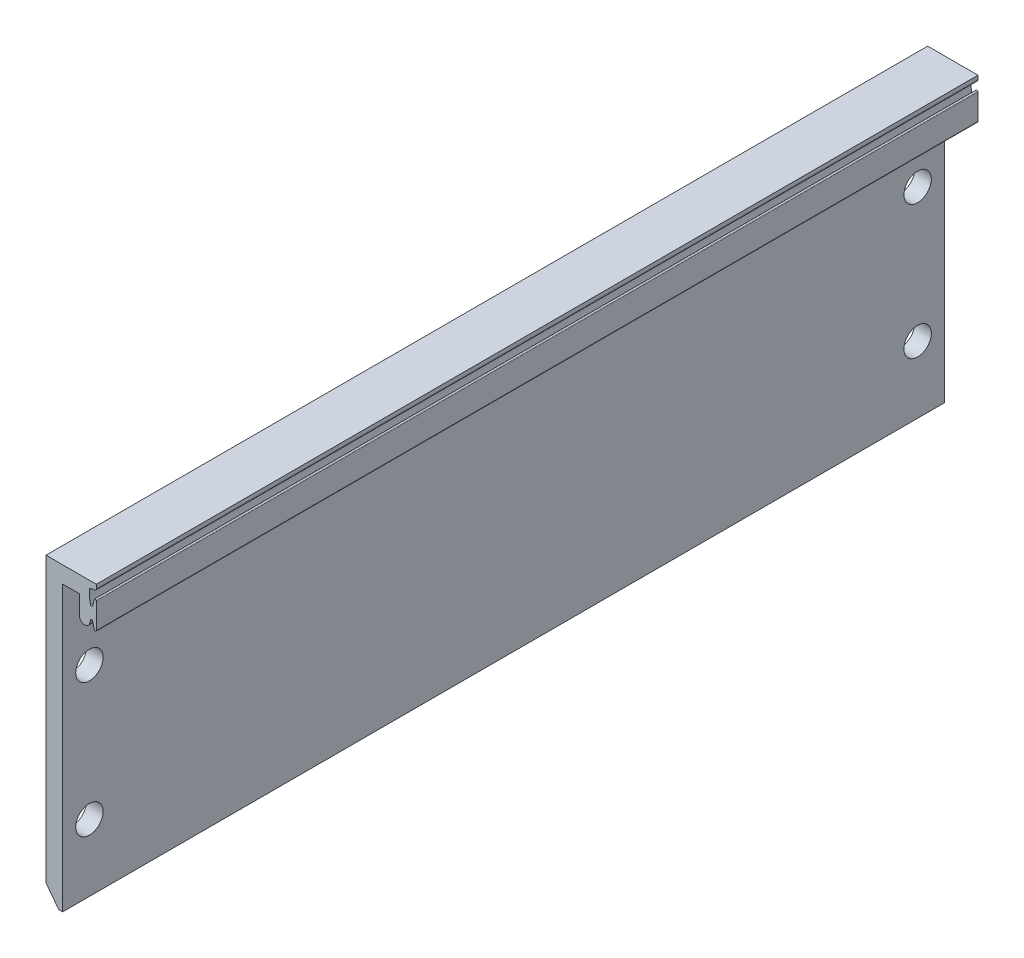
SolidWorks part; units mm, degrees
ref_plane "前视基准面" through (0, 0, 0) normal (0, 0, 1) x (1, 0, 0)
ref_plane "上视基准面" through (0, 0, 0) normal (0, 1, 0) x (1, 0, 0)
ref_plane "右视基准面" through (0, 0, 0) normal (1, 0, 0) x (0, 0, -1)
sketch "草图1" plane through (0, 0, 0) normal (0, 0, 1) x (1, 0, 0)
  line L3 (2260.201, -3063.3015) -> (2260.201, -3066.1678)
  line L4 (2262.741, -3060.8015) -> (2262.741, -3061.3761)
  line L6 (2261.7412, -3066.3727) -> (2261.8863, -3065.8372)
  line L7 (2262.1766, -3065.8405) -> (2262.4208, -3066.828)
  line L8 (2262.741, -3066.789) -> (2262.741, -3062.964)
  line L9 (2262.4208, -3062.925) -> (2262.1766, -3063.9125)
  line L10 (2261.9399, -3061.7612) -> (2262.489, -3061.6723)
  line L11 (2262.741, -3061.3761) -> (2262.741, -3060.8015)
  line L12 (2262.741, -3060.8015) -> (2255.201, -3060.8015)
  line L13 (2255.201, -3060.8015) -> (2255.201, -3103.3015)
  line L14 (2255.201, -3103.3015) -> (2257.101, -3105.8015)
  line L15 (2257.101, -3105.8015) -> (2257.701, -3105.8015)
  line L16 (2257.701, -3105.8015) -> (2257.701, -3063.3015)
  line L17 (2257.701, -3063.3015) -> (2260.201, -3063.3015)
  line L18 (2260.201, -3063.3015) -> (2260.201, -3066.1678)
  arc A0 (2260.201, -3066.1678) -> (2261.7412, -3066.3727) centre (2260.9847, -3066.1678) ccw
  arc A1 (2262.1766, -3065.8405) -> (2261.8863, -3065.8372) centre (2262.031, -3065.8765) ccw
  arc A2 (2262.4208, -3066.828) -> (2262.741, -3066.789) centre (2262.5785, -3066.789) ccw
  arc A3 (2262.741, -3062.964) -> (2262.4208, -3062.925) centre (2262.5785, -3062.964) ccw
  arc A4 (2261.8821, -3063.894) -> (2262.1766, -3063.9125) centre (2262.031, -3063.8765) ccw
  arc A5 (2261.6881, -3062.0453) -> (2261.8821, -3063.894) centre (2268.1291, -3062.304) ccw
  arc A6 (2261.9399, -3061.7612) -> (2261.6881, -3062.0453) centre (2261.9878, -3062.0573) ccw
  arc A7 (2262.489, -3061.6723) -> (2262.741, -3061.3761) centre (2262.441, -3061.3761) ccw
extrude "凸台-拉伸1" add sketch "草图1" along normal mid plane 132 contours L10 A7 L4 L12 L13 L14 L15 L16 L17 L3 A0 L6 A1 L7 A2 L8 A3 L9 A4 A5 A6
sketch "草图2" plane through (2255.201, 0, 0) normal (-1, 0, 0) x (0, 0, 1)
  line L0 (66, -3060.8015) -> (-66, -3060.8015) construction
  line L1 (-66, -3060.8015) -> (-66, -3103.3015) construction
  line L2 (0, -3060.8015) -> (0, -3105.8015) construction
  line L3 (66, -3105.8015) -> (-66, -3105.8015) construction
  circle A0 centre (-62, -3075.8015) radius 2.05
  circle A1 centre (-62, -3095.8015) radius 2.05
  circle A2 centre (62, -3095.8015) radius 2.05
  circle A3 centre (62, -3075.8015) radius 2.05
  dimension "D1" = 4.1
  dimension "D2" = 4.1
  dimension "D3" = 20
  dimension "D4" = 15
  dimension "D5" = 4
  dimension "D6" = 4
extrude "切除-拉伸1" cut sketch "草图2" against normal through all
sketch "草图3" plane through (2255.201, 0, 0) normal (-1, 0, 0) x (0, 0, 1)
  line L0 (-66, -3060.8015) -> (-66, -3103.3015) construction
  line L1 (66, -3060.8015) -> (-66, -3060.8015) construction
  circle A0 centre (62, -3075.8015) radius 2.05
  circle A1 centre (71.35, -3075.8015) radius 2.05
  circle A2 centre (71.35, -3095.8015) radius 2.05
  circle A3 centre (62, -3095.8015) radius 2.05
  point P4 (0, -3060.8015)
  dimension "D1" = 4.1
  dimension "D2" = 128
  dimension "D3" = 15
  dimension "D4" = 2
  dimension "D5" = 2
extrude "切除-拉伸2" [suppressed] cut sketch "草图3" against normal through all
equation "\"切除-拉伸2\" = if ( \"D1@凸台-拉伸1\" = 265.35 , \"unsuppressed\" , \"suppressed\" )"
